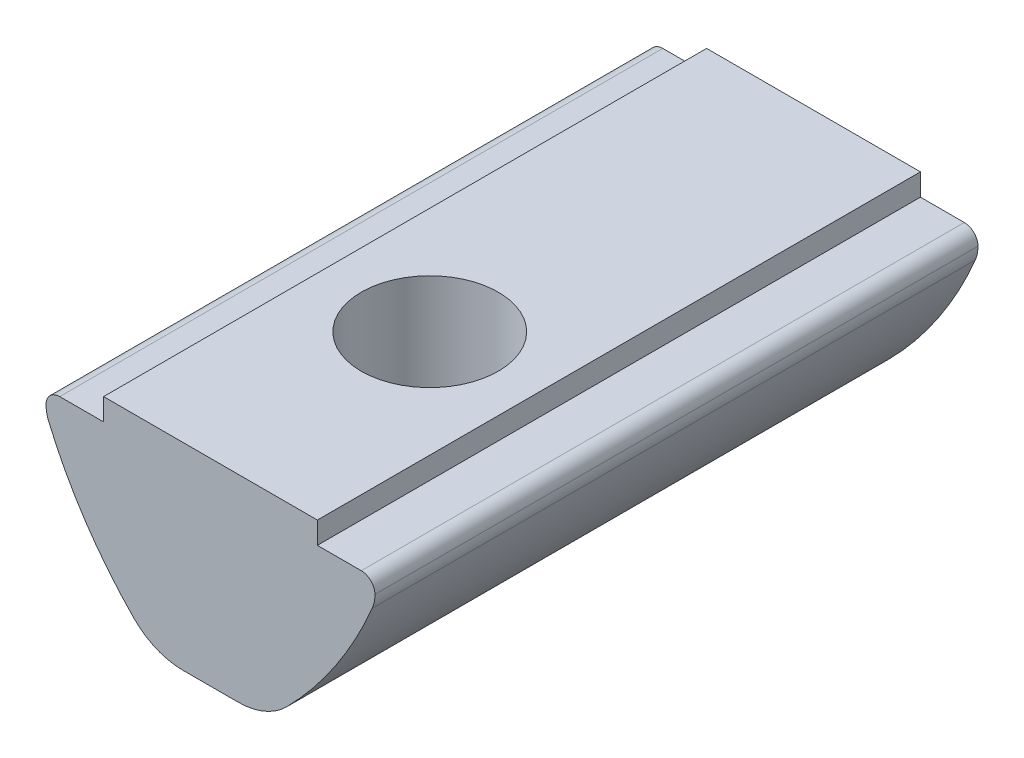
SolidWorks part; units mm, degrees
ref_plane "Ebene vorne" through (0, 0, 0) normal (0, 0, 1) x (1, 0, 0)
ref_plane "Ebene oben" through (0, 0, 0) normal (0, 1, 0) x (1, 0, 0)
ref_plane "Ebene rechts" through (0, 0, 0) normal (1, 0, 0) x (0, 0, -1)
imported_body "Importiert3"
sketch "Skizze1" plane through (0, -0.8, 0) normal (0, 1, 0) x (-1, 0, 0)
  line L0 (3.9, 0) -> (-3.9, 0)
  line L1 (-3.9, 0) -> (-3.9, 22)
  line L2 (3.9, 22) -> (3.9, 0)
  line L3 (-5.8956, 22) -> (5.8956, 22) construction
  line L4 (-3.9, 22) -> (3.9, 22)
  point P7 (0, 0)
  dimension "D1" = 7.8
extrude "Aufsatz-Linear austragen1" add sketch "Skizze1" along normal blind 0.8
ref_plane "Ebene1" through (0, 0, 5) normal (0, 0, 1) x (1, 0, 0)
sketch "Skizze3" plane through (0, 0, 5) normal (0, 0, 1) x (1, 0, 0)
  line L0 (2.5, -1.2) -> (0, -1.2)
  line L1 (0, -1.2) -> (0, -7.2)
  line L2 (0, -7.2) -> (2.5, -7.2)
  line L3 (2.5, -7.2) -> (2.5, -1.2)
  line L4 (0, -1.2) -> (0, -7.2) construction
revolve "Schnitt-Rotation1" cut sketch "Skizze3" angle 360 about L4
hole_wizard "M6 Gewindebohrung1" positions "Skizze5" profile "Skizze4" tap size "M6" standard "DIN"
sketch "Skizze5" plane through (0, 0, 0) normal (0, 1, 0) x (1, 0, 0)
  point P0 (0, -14)
sketch "Skizze4" plane through (0, 0, 14) normal (1, 0, 0) x (0, 0, 1)
  line L0 (0, 0) -> (0, 7.3567)
  line L1 (0, 7.3567) -> (2.5, 7.3567)
  line L2 (2.5, 7.3567) -> (2.5, 0)
  line L5 (2.5, 0) -> (0, 0)
  line L11 (0, -6.35) -> (0, 107.95) construction
  dimension "Nenndurchmesser (Haupt)" = 5
  dimension "Bohrungstiefe" = 7.3567
fillet "Verrundung2" radius 0.5 2 edges at (-5.8956, -0.8, 11) (5.8956, -0.8, 11)
fillet "Verrundung3" radius 2.5 2 edges at (-2, -7.2, 1.75) (2, -7.2, 18.75)
